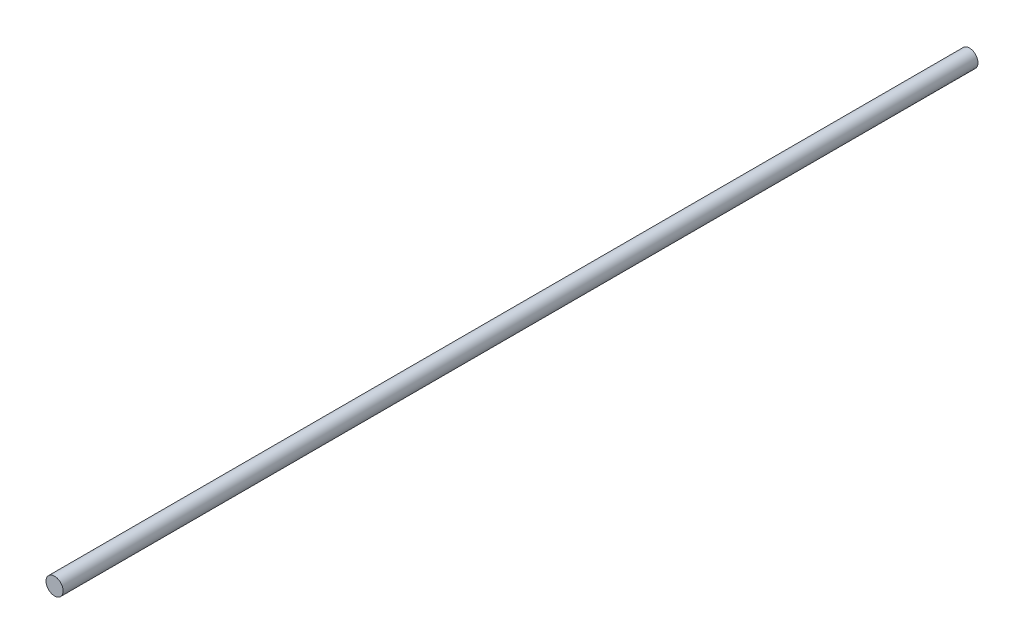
SolidWorks part; units mm, degrees
ref_plane "Front Plane" through (0, 0, 0) normal (0, 0, 1) x (1, 0, 0)
ref_plane "Top Plane" through (0, 0, 0) normal (0, 1, 0) x (1, 0, 0)
ref_plane "Right Plane" through (0, 0, 0) normal (1, 0, 0) x (0, 0, -1)
sketch "Sketch1" plane through (0, 0, 0) normal (0, 0, 1) x (1, 0, 0)
  circle A0 centre (0, 0) radius 30
  dimension "D1" = 60
extrude "Boss-Extrude1" add sketch "Sketch1" against normal blind 3200
